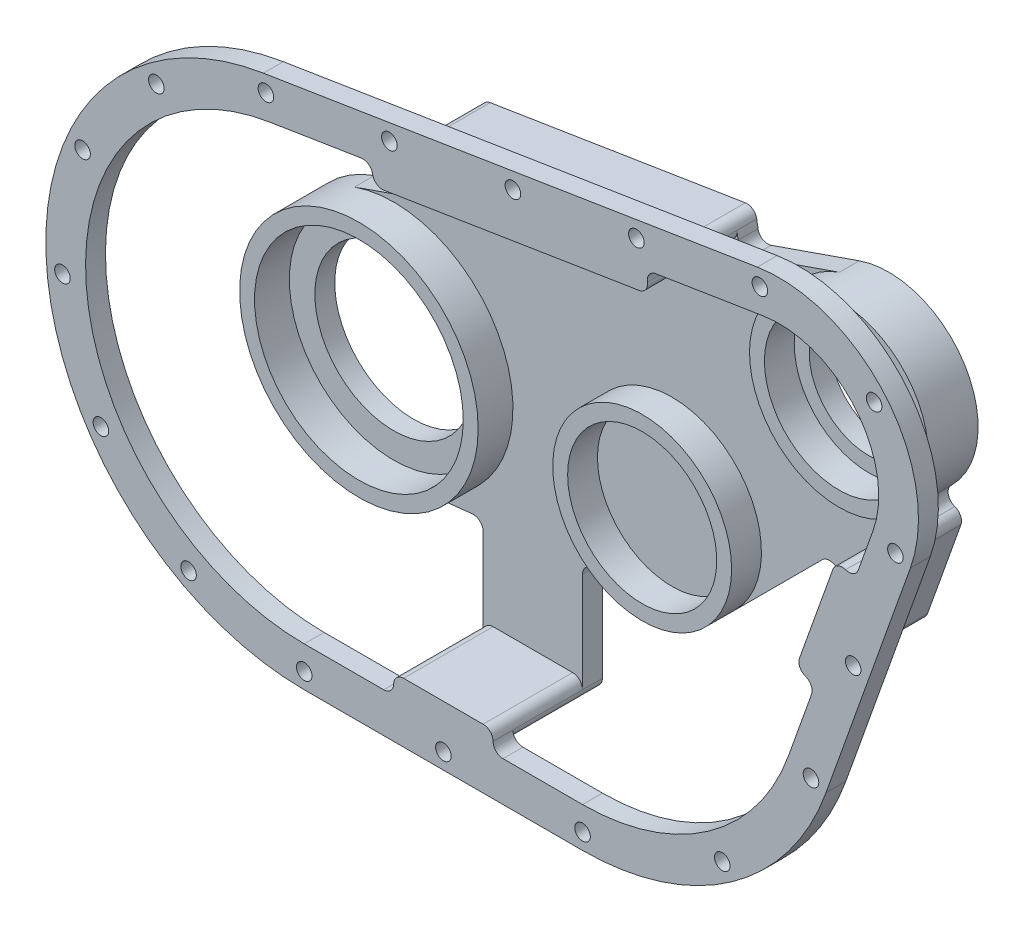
SolidWorks part; units mm, degrees
ref_plane "Front Plane" through (0, 0, 0) normal (0, 0, 1) x (1, 0, 0)
ref_plane "Top Plane" through (0, 0, 0) normal (0, 1, 0) x (1, 0, 0)
ref_plane "Right Plane" through (0, 0, 0) normal (1, 0, 0) x (0, 0, -1)
sketch "Sketch1" plane through (0, 0, 0) normal (0, 0, 1) x (1, 0, 0)
  line L0 (0, 0) -> (88.9, 0) construction
  line L1 (88.9, 0) -> (151.7618, 62.8618) construction
  line L2 (142.3758, 89.8513) -> (84.4546, 69.7084)
  line L3 (-11.0336, 68.973) -> (146.7465, 94.2132) construction
  line L4 (4.0821, -37.8807) -> (28.575, -35.2413)
  line L5 (28.575, -69.85) -> (60.325, -69.85)
  line L6 (181.6678, 52.1992) -> (154.6933, -23.4578) construction
  line L7 (171.9674, 42.6562) -> (168.1336, 38.8225)
  line L8 (28.575, -69.85) -> (28.575, -35.2413)
  line L9 (60.325, -69.85) -> (60.325, -31.8198)
  line L10 (175.91, 36.0499) -> (168.1336, 38.8225)
  line L11 (163.1149, 0.1627) -> (138.3157, 9.0045)
  line L12 (0, -69.85) -> (88.9, -69.85) construction
  line L13 (163.1149, 0.1627) -> (175.91, 36.0499)
  line L14 (21.341, 74.152) -> (25.3404, 49.1506)
  line L15 (109.1248, 88.1948) -> (110.6261, 78.8099)
  line L16 (21.341, 74.152) -> (109.1248, 88.1948)
  line L17 (25.3404, 49.1506) -> (-12.5146, 35.986)
  line L18 (60.325, -31.8198) -> (91.9616, -28.4105)
  line L19 (138.3157, 9.0045) -> (109.0655, -20.2457)
  circle A0 centre (0, 0) radius 25.1841
  circle A1 centre (0, 0) radius 69.85 construction
  circle A2 centre (151.7618, 62.8618) radius 19.05
  circle A3 centre (88.9, 0) radius 23.8125
  circle A4 centre (151.7618, 62.8618) radius 23.8125
  circle A5 centre (88.9, 0) radius 28.575
  circle A6 centre (151.7618, 62.8618) radius 28.575
  circle A7 centre (0, 0) radius 33.3375
  circle A8 centre (0, 0) radius 38.1
  circle A9 centre (88.9, 0) radius 69.85 construction
  circle A10 centre (151.7618, 62.8618) radius 31.75 construction
  dimension "D1" = 50.3682
  dimension "D2" = 139.7
  dimension "D3" = 38.1
  dimension "D4" = 47.625
  dimension "D5" = 47.625
  dimension "D6" = 57.15
  dimension "D7" = 57.15
  dimension "D8" = 66.675
  dimension "D9" = 76.2
  dimension "D13" = 139.7
  dimension "D14" = 63.5
  dimension "D10" = 88.9
  dimension "D11" = 88.9
  dimension "D12" = 225
  dimension "D15" = 31.75
  dimension "D16" = 28.575
  dimension "D17" = 38.1
  dimension "D18" = 17.145
  dimension "D19" = 88.9
  dimension "D20" = 38.1
extrude "Boss-Extrude1" add sketch "Sketch1" along normal blind 6.35
sketch "Sketch2" plane through (0, 0, 6.35) normal (0, 0, 1) x (1, 0, 0)
  circle A0 centre (151.7618, 62.8618) radius 23.8125
  circle A1 centre (151.7618, 62.8618) radius 28.575
  circle A2 centre (88.9, 0) radius 23.8125
  circle A3 centre (88.9, 0) radius 28.575
  dimension "D1" = 57.15
  dimension "D2" = 57.15
  dimension "D3" = 47.625
  dimension "D4" = 47.625
extrude "Boss-Extrude2" add sketch "Sketch2" along normal blind 9.525
sketch "Sketch3" plane through (0, 0, 6.35) normal (0, 0, 1) x (1, 0, 0)
  circle A0 centre (0, 0) radius 33.3375
  circle A1 centre (0, 0) radius 38.1
  dimension "D1" = 76.2
  dimension "D2" = 66.675
extrude "Boss-Extrude3" add sketch "Sketch3" along normal blind 11.1125
sketch "Sketch4" plane through (0, 0, 6.35) normal (0, 0, 1) x (1, 0, 0)
  line L0 (21.341, 74.152) -> (109.1248, 88.1948)
  line L1 (109.1248, 88.1948) -> (110.1279, 81.9246)
  line L2 (109.1248, 88.1948) -> (110.6261, 78.8099) construction
  line L3 (110.1279, 81.9246) -> (22.344, 67.8817)
  line L4 (21.341, 74.152) -> (25.3404, 49.1506) construction
  line L5 (22.344, 67.8817) -> (21.341, 74.152)
  line L6 (175.91, 36.0499) -> (163.1149, 0.1627)
  line L7 (163.1149, 0.1627) -> (175.91, 36.0499) construction
  line L8 (163.1149, 0.1627) -> (157.1336, 2.2952)
  line L9 (163.1149, 0.1627) -> (138.3157, 9.0045) construction
  line L10 (157.1336, 2.2952) -> (169.9288, 38.1824)
  line L11 (175.91, 36.0499) -> (168.1336, 38.8225) construction
  line L12 (169.9288, 38.1824) -> (175.91, 36.0499)
  line L13 (60.325, -69.85) -> (28.575, -69.85)
  line L14 (28.575, -69.85) -> (60.325, -69.85) construction
  line L15 (28.575, -69.85) -> (28.575, -63.5)
  line L16 (28.575, -69.85) -> (28.575, -35.2413) construction
  line L17 (28.575, -63.5) -> (60.325, -63.5)
  line L18 (60.325, -69.85) -> (60.325, -31.8198) construction
  line L19 (60.325, -63.5) -> (60.325, -69.85)
  dimension "D1" = 6.35
  dimension "D2" = 6.35
  dimension "D3" = 6.35
extrude "Boss-Extrude4" add sketch "Sketch4" along normal blind 28.575
sketch "Sketch5" plane through (0, 0, 34.925) normal (0, 0, 1) x (1, 0, 0)
  line L0 (-11.0336, 68.973) -> (146.7465, 94.2132)
  line L1 (181.6678, 52.1992) -> (154.6933, -23.4578)
  line L2 (88.9, -69.85) -> (0, -69.85)
  line L3 (88.9, -82.55) -> (0, -82.55)
  line L4 (193.6302, 47.9341) -> (166.6557, -27.7228)
  line L5 (-13.0398, 81.5136) -> (144.7404, 106.7537)
  line L6 (88.9, -77.47) -> (0, -77.47) construction
  line L7 (188.8453, 49.6401) -> (161.8707, -26.0168) construction
  line L8 (-12.2373, 76.4974) -> (145.5428, 101.7375) construction
  arc A0 (-11.0336, 68.973) -> (0, -69.85) centre (0, 0) ccw
  arc A1 (88.9, -69.85) -> (154.6933, -23.4578) centre (88.9, 0) ccw
  arc A2 (181.6678, 52.1992) -> (146.7465, 94.2132) centre (151.7618, 62.8618) ccw
  arc A3 (-13.0398, 81.5136) -> (0, -82.55) centre (0, 0) ccw
  arc A4 (88.9, -82.55) -> (166.6557, -27.7228) centre (88.9, 0) ccw
  arc A5 (193.6302, 47.9341) -> (144.7404, 106.7537) centre (151.7618, 62.8618) ccw
  arc A6 (-12.2373, 76.4974) -> (0, -77.47) centre (0, 0) ccw construction
  arc A7 (88.9, -77.47) -> (161.8707, -26.0168) centre (88.9, 0) ccw construction
  arc A8 (188.8453, 49.6401) -> (145.5428, 101.7375) centre (151.7618, 62.8618) ccw construction
  dimension "D1" = 12.7
  dimension "D2" = 7.62
extrude "Boss-Extrude5" add sketch "Sketch5" against normal blind 6.35
fillet "Fillet1" radius 3.175 12 edges at (22.344, 67.8817, 20.6375) (21.341, 74.152, 31.75) (109.1248, 88.1948, 31.75) (110.1279, 81.9246, 20.6375) (175.91, 36.0499, 31.75) (169.9288, 38.1824, 20.6375) (163.1149, 0.1627, 31.75) (157.1336, 2.2952, 20.6375) (60.325, -69.85, 31.75) (60.325, -63.5, 20.6375) (28.575, -63.5, 20.6375) (28.575, -69.85, 31.75)
fillet "Fillet2" radius 3.175 12 edges at (28.575, -69.85, 14.2875) (60.325, -69.85, 14.2875) (21.341, 74.152, 14.2875) (109.1248, 88.1948, 14.2875) (175.91, 36.0499, 14.2875) (163.1149, 0.1627, 14.2875) (60.325, -31.8198, 3.175) (138.3157, 9.0045, 3.175) (168.1336, 38.8225, 3.175) (110.6261, 78.8099, 3.175) (28.575, -35.2413, 3.175) (25.3404, 49.1506, 3.175)
sketch "Sketch6" plane through (0, 0, 34.925) normal (0, 0, 1) x (1, 0, 0)
  circle A0 centre (-12.2373, 76.4974) radius 2.4892
  dimension "D1" = 4.9784
extrude "Cut-Extrude1" cut sketch "Sketch6" against normal through all
pattern_curve "CrvPattern1" of "Cut-Extrude1" parameters "D1"=7, "D3"=50.8, "D2"=1, "D4"=2.54
pattern_curve "CrvPattern2" of "Cut-Extrude1" parameters "D1"=5, "D3"=50.8, "D2"=1, "D4"=2.54
sketch "Sketch7" plane through (0, 0, 34.925) normal (0, 0, 1) x (1, 0, 0)
  circle A0 centre (188.8453, 49.6401) radius 2.4892
  dimension "D1" = 4.9784
extrude "Cut-Extrude2" cut sketch "Sketch7" against normal through all
pattern_curve "CrvPattern3" of "Cut-Extrude2" parameters "D1"=3, "D3"=50.8, "D2"=1, "D4"=2.54
pattern_curve "CrvPattern4" of "Cut-Extrude2" parameters "D1"=3, "D3"=50.8, "D2"=1, "D4"=2.54
sketch "Sketch8" plane through (0, 0, 34.925) normal (0, 0, 1) x (1, 0, 0)
  circle A0 centre (88.9, -77.47) radius 2.4892
  dimension "D1" = 4.9784
extrude "Cut-Extrude3" cut sketch "Sketch8" against normal through all
pattern_curve "CrvPattern5" of "Cut-Extrude3" parameters "D1"=3, "D3"=50.8, "D2"=1, "D4"=2.54
pattern_curve "CrvPattern6" of "Cut-Extrude3" parameters "D1"=3, "D3"=50.8, "D2"=1, "D4"=2.54
